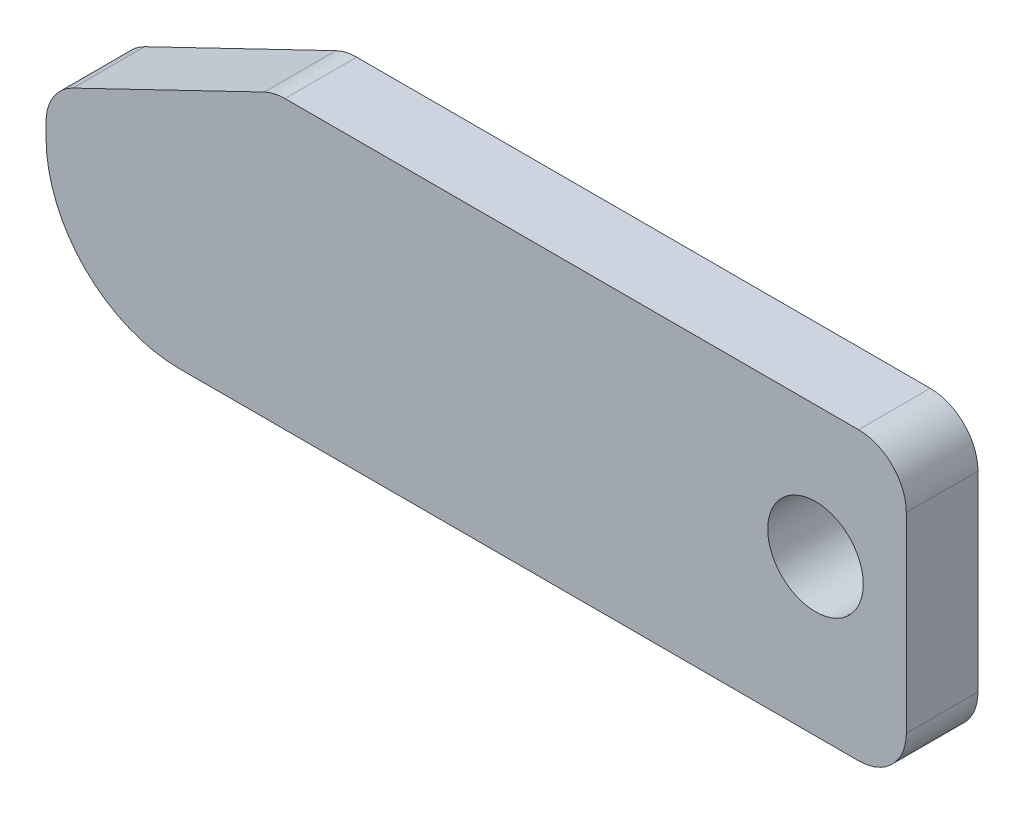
SolidWorks part; units mm, degrees
ref_plane "Face" through (0, 0, 0) normal (0, 0, 1) x (1, 0, 0)
ref_plane "Dessus" through (0, 0, 0) normal (0, 1, 0) x (1, 0, 0)
ref_plane "Droite" through (0, 0, 0) normal (1, 0, 0) x (0, 0, -1)
sketch "Esquisse1" plane through (0, 0, 0) normal (0, 0, 1) x (1, 0, 0)
  line L0 (-134.3421, 59.0081) -> (-174.3421, 39.7272)
  line L1 (-130, 60) -> (-10, 60)
  line L2 (-180, 30.7191) -> (-180, 28)
  line L3 (-152, 0) -> (-10, 0)
  line L4 (0, 50) -> (0, 10)
  arc A0 (-152, 0) -> (-180, 28) centre (-152, 28) cw
  circle A1 centre (-19, 32.5) radius 10
  arc A2 (-174.3421, 39.7272) -> (-180, 30.7191) centre (-170, 30.7191) ccw
  arc A3 (-130, 60) -> (-134.3421, 59.0081) centre (-130, 50) ccw
  arc A4 (0, 50) -> (-10, 60) centre (-10, 50) ccw
  arc A5 (-10, 0) -> (0, 10) centre (-10, 10) ccw
  point P6 (-180, 0)
  point P13 (-180, 37)
  point P16 (-132.2843, 60)
  point P21 (0, 0)
  dimension "D5" = 28
  dimension "D6" = 20
  dimension "D9" = 10
  dimension "D4" = 10
  dimension "D1" = 60
  dimension "D2" = 37
  dimension "D3" = 180
  dimension "D7" = 161
  dimension "D8" = 32.5
  dimension "D10" = 120
extrude "Base-Extrusion" add sketch "Esquisse1" along normal blind 15
